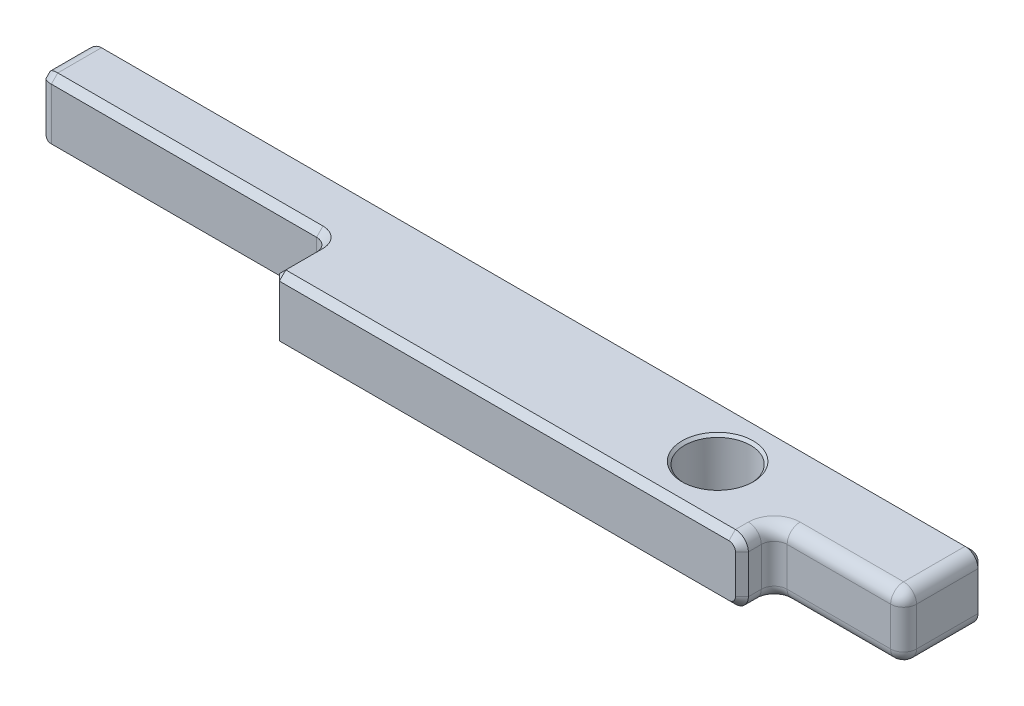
SolidWorks part; units mm, degrees
ref_plane "Front" through (0, 0, 0) normal (0, 0, 1) x (1, 0, 0)
ref_plane "Top" through (0, 0, 0) normal (0, 1, 0) x (1, 0, 0)
ref_plane "Right" through (0, 0, 0) normal (1, 0, 0) x (0, 0, -1)
sketch "Sketch1" plane through (0, 0, 0) normal (0, 0, 1) x (1, 0, 0)
  line L1 (-133.35, -6.35) -> (41.275, -6.35)
  line L2 (-133.35, -6.35) -> (-133.35, 6.35)
  line L3 (-133.35, 6.35) -> (41.275, 6.35)
  line L4 (41.275, -6.35) -> (41.275, 6.35)
  dimension "D1" = 12.7
  dimension "D2" = 174.625
  dimension "D3" = 6.35
  dimension "D4" = 41.275
extrude "Extrude1" add sketch "Sketch1" along normal mid plane 22.225
sketch "Sketch2" plane through (0, 6.35, 0) normal (0, 1, 0) x (-1, 0, 0)
  circle A0 centre (0, 0) radius 6.477
  dimension "D1" = 12.954
extrude "Cut-Extrude1" cut sketch "Sketch2" against normal through all
sketch "Sketch4" plane through (0, 0, 11.1125) normal (0, 0, 1) x (1, 0, 0)
  line L1 (15.875, 14.5172) -> (50.9772, 14.5172)
  line L2 (15.875, 14.5172) -> (15.875, -14.3521)
  line L3 (15.875, -14.3521) -> (50.9772, -14.3521)
  line L4 (50.9772, 14.5172) -> (50.9772, -14.3521)
  line L5 (41.275, -6.35) -> (41.275, 6.35) construction
  dimension "D1" = 25.4
extrude "Cut-Extrude3" cut sketch "Sketch4" against normal blind 6.35
sketch "Sketch3" plane through (0, 0, 11.1125) normal (0, 0, 1) x (1, 0, 0)
  line L1 (-152.4, -12.7) -> (-76.2, -12.7)
  line L2 (-152.4, -12.7) -> (-152.4, 12.7)
  line L3 (-152.4, 12.7) -> (-76.2, 12.7)
  line L4 (-76.2, -12.7) -> (-76.2, 12.7)
  dimension "D1" = 76.2
  dimension "D2" = 25.4
  dimension "D3" = 12.7
  dimension "D4" = 76.2
extrude "Cut-Extrude2" cut sketch "Sketch3" against normal blind 11.1125
chamfer "Chamfer1" distance 0.508 angle 45 2 edges at (0, -6.35, 6.477) (0, 6.35, 6.477)
fillet "Fillet1" radius 2.54 13 edges at (15.875, 6.35, 7.9375) (15.875, -6.35, 7.9375) (41.275, 6.35, -3.175) (41.275, -6.35, -3.175) (41.275, 0, 4.7625) (28.575, 6.35, 4.7625) (28.575, -6.35, 4.7625) (15.875, 0, 4.7625) (-76.2, 0, 0) (-133.35, 0, 0) (-133.35, -6.35, -5.5562) (-133.35, 0, -11.1125) (-133.35, 6.35, -5.5562)
chamfer "Chamfer3" distance 1.27 angle 45 21 edges at (40.5311, -5.6061, -11.1125) (41.275, 0, -11.1125) (40.5311, 5.6061, -11.1125) (15.1311, 5.6061, 11.1125) (15.875, 0, 11.1125) (15.1311, -5.6061, 11.1125) (-31.4325, 6.35, 11.1125) (-31.4325, -6.35, 11.1125) (-46.0375, 6.35, -11.1125) (-46.0375, -6.35, -11.1125) (-104.775, 6.35, 0) (-76.9439, 6.35, 0.7439) (-76.2, 6.35, 6.8262) (-76.2, 0, 11.1125) (-76.2, -6.35, 6.8262) (-76.9439, -6.35, 0.7439) (-104.775, -6.35, 0) (-132.6061, 5.6061, -10.3686) (-132.6061, -5.6061, -10.3686) (-132.6061, 5.6061, -0.7439) (-132.6061, -5.6061, -0.7439)
